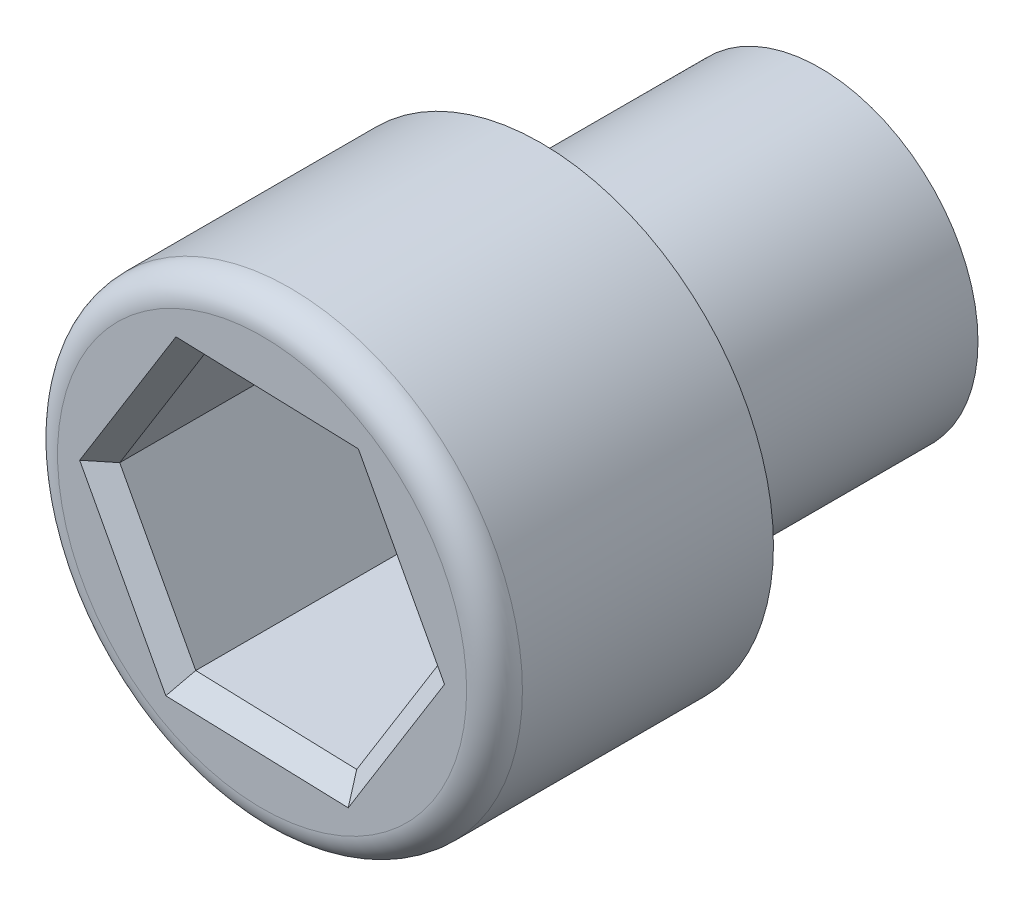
SolidWorks part; units mm, degrees
ref_plane "Płaszczyzna przednia" through (0, 0, 0) normal (0, 0, 1) x (1, 0, 0)
ref_plane "Płaszczyzna górna" through (0, 0, 0) normal (0, 1, 0) x (1, 0, 0)
ref_plane "Płaszczyzna prawa" through (0, 0, 0) normal (1, 0, 0) x (0, 0, -1)
sketch "Szkic1" plane through (0, 0, 0) normal (0, 0, 1) x (1, 0, 0)
  circle A0 centre (0, 0) radius 1.7
  dimension "D1" = 3.4
extrude "Dodanie-wyciągnięcie1" add sketch "Szkic1" along normal blind 3
sketch "Szkic2" plane through (0, 0, 3) normal (0, 0, 1) x (1, 0, 0)
  circle A0 centre (0, 0) radius 2.5
  dimension "D1" = 5
extrude "Dodanie-wyciągnięcie2" add sketch "Szkic2" along normal blind 3
fillet "Zaokrąglenie1" radius 0.3 1 edges at (2.5, 0, 6)
sketch "Szkic3" plane through (0, 0, 6) normal (0, 0, 1) x (1, 0, 0)
  line L1 (-0.8174, 1.527) -> (-1.7312, 0.0556)
  line L2 (-1.7312, 0.0556) -> (-0.9137, -1.4714)
  line L3 (-0.9137, -1.4714) -> (0.8174, -1.527)
  line L4 (0.8174, -1.527) -> (1.7312, -0.0556)
  line L5 (1.7312, -0.0556) -> (0.9137, 1.4714)
  line L6 (0.9137, 1.4714) -> (-0.8174, 1.527)
  circle A0 centre (0, 0) radius 1.5 construction
  dimension "D1" = 3
extrude "Wytnij-wyciągnięcie1" cut sketch "Szkic3" against normal blind 3
chamfer "Sfazowanie1" distance 0.2 angle 45 6 edges at (-0.0481, -1.4992, 6) (-1.3224, -0.7079, 6) (-1.2743, 0.7913, 6) (0.0481, 1.4992, 6) (1.3224, 0.7079, 6) (1.2743, -0.7913, 6)
